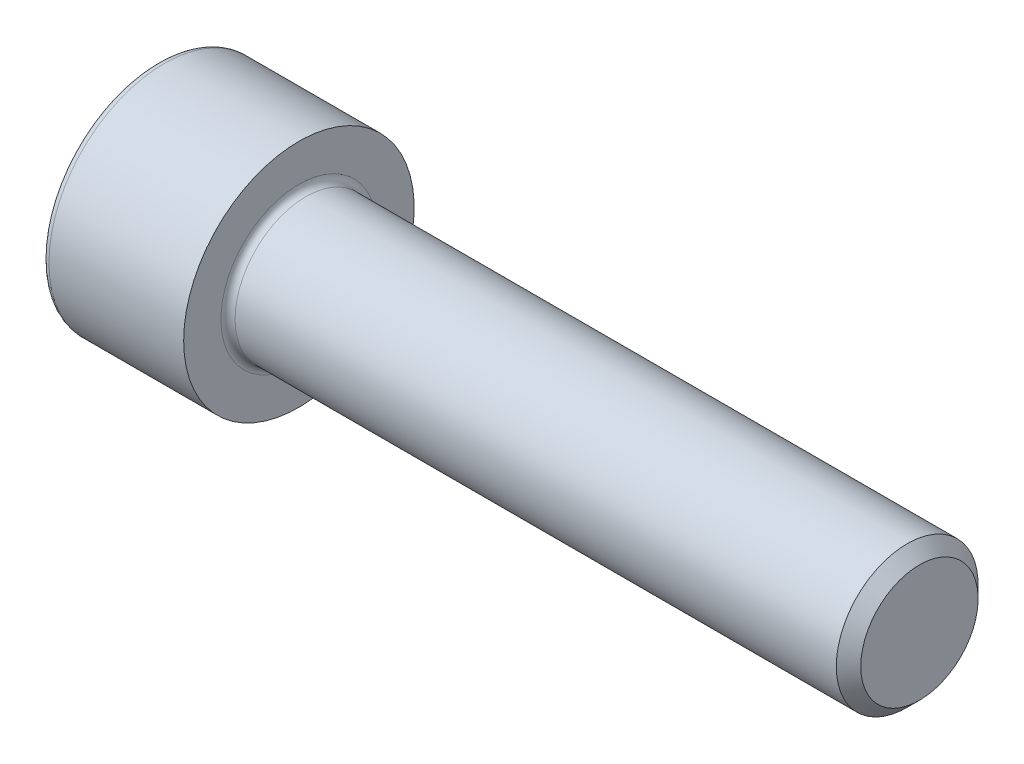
SolidWorks part; units mm, degrees
ref_plane "Plane1" through (0, 0, 0) normal (0, 0, 1) x (1, 0, 0)
ref_plane "Plane2" through (0, 0, 0) normal (0, 1, 0) x (1, 0, 0)
ref_plane "Plane3" through (0, 0, 0) normal (1, 0, 0) x (0, 0, -1)
sketch "BodySke" plane through (0, 0, 0) normal (0, 0, 1) x (1, 0, 0)
  line L0 (0, 0) -> (0, 6.5)
  line L1 (0, 6.5) -> (8, 6.5)
  line L2 (8, 6.5) -> (8, 4)
  line L3 (8, 4) -> (42.3095, 4)
  line L4 (43, 3.3095) -> (43, 0)
  line L5 (43, 0) -> (0, 0)
  line L6 (-31.75, 0) -> (127, 0) construction
  line L8 (43, 3.3095) -> (42.3095, 4)
  line L10 (43, -3.3095) -> (42.3095, -4) construction
  line L11 (9.25, 9.525) -> (9.25, 3.175) construction
  line L12 (8, 9.525) -> (8, 3.175) construction
  line L13 (-17, 9.525) -> (-17, 3.175) construction
  dimension "Diameter" = 8
  dimension "Head_ht" = 8
  dimension "Length" = 35
  dimension "Body_ch_ang" = 45
  dimension "Head_dia" = 13
  dimension "Minor_dia" = 6.619
  dimension "Advance" = 1.25
  dimension "Thread_nom" = 35
  dimension "Thread_length" = 60
revolve "Base-Revolve" add sketch "BodySke"
fillet "Fillet1" radius 0.4 1 edges at (8, 0, 4)
fillet "Fillet2" radius 0.4 1 edges at (0, 0, 6.5)
sketch "Sketch2" plane through (0, 0, 0) normal (0, 0, 1) x (1, 0, 0)
  line L0 (0, 3.0475) -> (4, 3.0475)
  line L1 (4, 3.0475) -> (5.7595, 0)
  line L2 (-31.75, 0) -> (127, 0) construction
  line L3 (5.7595, 0) -> (0, 0)
  line L4 (0, 0) -> (0, 3.0475)
  line L6 (0, 0) -> (47.625, 0) construction
  dimension "D1" = 3.0475
  dimension "D2" = 60
  dimension "Depth" = 4
revolve "Hex-PreBroach" cut sketch "Sketch2" angle 360 about L6
sketch "Sketch3" plane through (0, 0, 0) normal (-1, 0, 0) x (0, 0.5, 0.866)
  line L0 (1.7595, 3.0475) -> (-1.7595, 3.0475)
  line L1 (-1.7595, 3.0475) -> (-3.5189, 0)
  line L2 (1.7595, 3.0475) -> (3.5189, 0)
  line L3 (1.7595, -3.0475) -> (3.5189, 0)
  line L4 (1.7595, -3.0475) -> (-1.7595, -3.0475)
  line L5 (-1.7595, -3.0475) -> (-3.5189, 0)
  dimension "D1" = 3.0475
  dimension "D2" = 3.0475
  dimension "Hex_size" = 6.095
extrude "Hex" cut sketch "Sketch3" against normal blind 4
sketch "ThdSchSke" plane through (0, 0, 0) normal (0, 0, 1) x (1, 0, 0)
  line L0 (11.75, -3.3095) -> (11.2665, -4)
  line L1 (11.75, -3.3095) -> (12.2335, -4)
  line L2 (12.2335, -4) -> (12.2335, -5)
  line L3 (-3.175, 0) -> (5.1513, 0) construction
  line L4 (0, 6.1) -> (0, -6.1) construction
  line L5 (12.2335, -5) -> (11.2665, -5)
  line L6 (11.2665, -5) -> (11.2665, -4)
  dimension "Thread_minor" = 6.619
  dimension "Diameter" = 8
  dimension "Start" = 11.75
  dimension "SideAngle" = 55
  dimension "VeeAngle" = 70
  dimension "Overcut" = 10
revolve "ThreadSchematic" [suppressed] cut sketch "ThdSchSke" angle 360 about L3
pattern_linear "ThdSchPat" [suppressed]
equation "\"D2@Sketch3\" = \"Hex_size@Sketch3\" / 2"
equation "\"D1@Sketch3\" = \"Hex_size@Sketch3\" / 2"
equation "\"D1@Sketch2\" = \"Hex_size@Sketch3\" / 2"
equation "\"Thread_minor@ThreadCosmetic\"  =  \"Minor_dia@BodySke\""
equation "\"Depth@Sketch2\" =  \"Key_eng@Hex\""
equation "\"Thread_length@ThreadCosmetic\" = ((sgn( (\"Length@BodySke\" - \"Advance@BodySke\" * 3.0) - \"Thread_nom@BodySke\" )-1)*( (\"Length@BodySke\" - \"Advance@BodySke\" * 3.0) - \"Thread_nom@BodySke\" ))/-2+ \"Thread_no"
equation "\"Thread_minor@ThdSchSke\" = \"Minor_dia@BodySke\""
equation "\"Diameter@ThdSchSke\" = \"Diameter@BodySke\""
equation "\"Overcut@ThdSchSke\" = \"Diameter@BodySke\" * 1.25"
equation "\"Start@ThdSchSke\" = \"Head_ht@BodySke\" + \"Length@BodySke\" - \"Thread_length@ThreadCosmetic\"  '---Non-countersunk---"
equation "\"Num_threads@ThdSchPat\" = int( \"Thread_length@ThreadCosmetic\" / \"Advance@BodySke\" + 0.999 )  + 1"
equation "\"Advance@ThdSchPat\" = \"Thread_length@ThreadCosmetic\" /  (\"Num_threads@ThdSchPat\" - 1) 'relax it"
equation "\"Num_threads@ThdSchPat\" = \"Num_threads@ThdSchPat\" - sgn( \"Num_threads@ThdSchPat\" - 1) '---chamfered tips only---"
